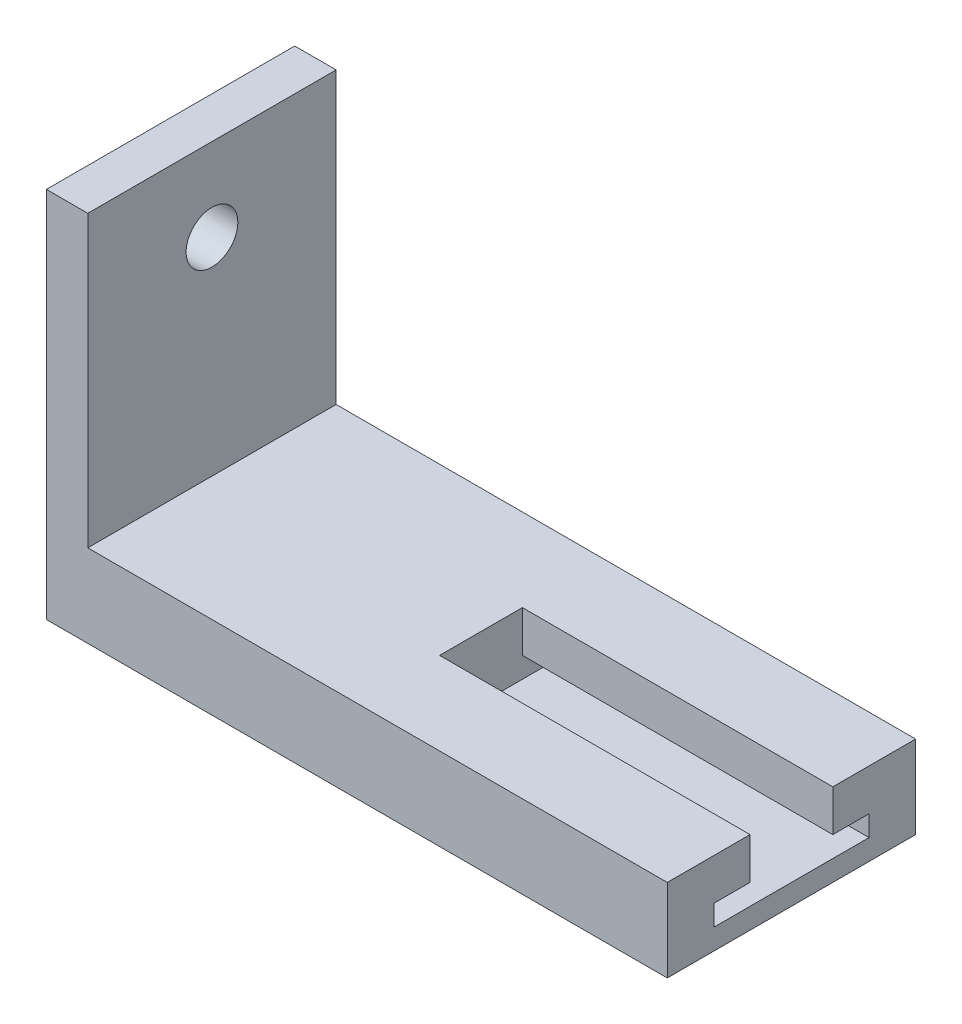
SolidWorks part; units mm, degrees
ref_plane "Plane1" through (0, 0, 0) normal (0, 0, 1) x (1, 0, 0)
ref_plane "Plane2" through (0, 0, 0) normal (0, 1, 0) x (1, 0, 0)
ref_plane "Plane3" through (0, 0, 0) normal (1, 0, 0) x (0, 0, -1)
sketch "Sketch1" plane through (0, 0, 0) normal (0, 0, 1) x (1, 0, 0)
  line L0 (0, 0) -> (0, 40)
  line L1 (0, 40) -> (-280, 40)
  line L2 (-280, 40) -> (-280, 180)
  line L3 (-280, 180) -> (-300, 180)
  line L4 (-300, 180) -> (-300, 0)
  line L5 (-300, 0) -> (0, 0)
  dimension "D1" = 300
  dimension "D2" = 40
  dimension "D3" = 180
  dimension "D4" = 20
extrude "Base-Extrude" add sketch "Sketch1" along normal mid plane 120
sketch "Sketch2" plane through (0, 0, 0) normal (1, 0, 0) x (0, 0, -1)
  line L0 (20, 40) -> (20, 20)
  line L1 (-60, 40) -> (60, 40) construction
  line L2 (20, 20) -> (37.5, 20)
  line L3 (37.5, 20) -> (37.5, 10)
  line L4 (37.5, 10) -> (-37.5, 10)
  line L5 (-37.5, 10) -> (-37.5, 20)
  line L6 (-37.5, 20) -> (-20, 20)
  line L7 (-20, 20) -> (-20, 40)
  line L8 (-20, 40) -> (20, 40)
  line L9 (0, 40) -> (0, 10) construction
  dimension "D1" = 10
  dimension "D2" = 30
  dimension "D3" = 75
  dimension "D4" = 40
extrude "Cut-Extrude1" cut sketch "Sketch2" against normal blind 150
sketch "Sketch3" plane through (-280, 0, 0) normal (1, 0, 0) x (0, 0, -1)
  line L0 (-60, 40) -> (60, 40) construction
  circle A0 centre (0, 140) radius 12.5
  dimension "D1" = 25
  dimension "D2" = 100
extrude "Cut-Extrude2" cut sketch "Sketch3" against normal through all
